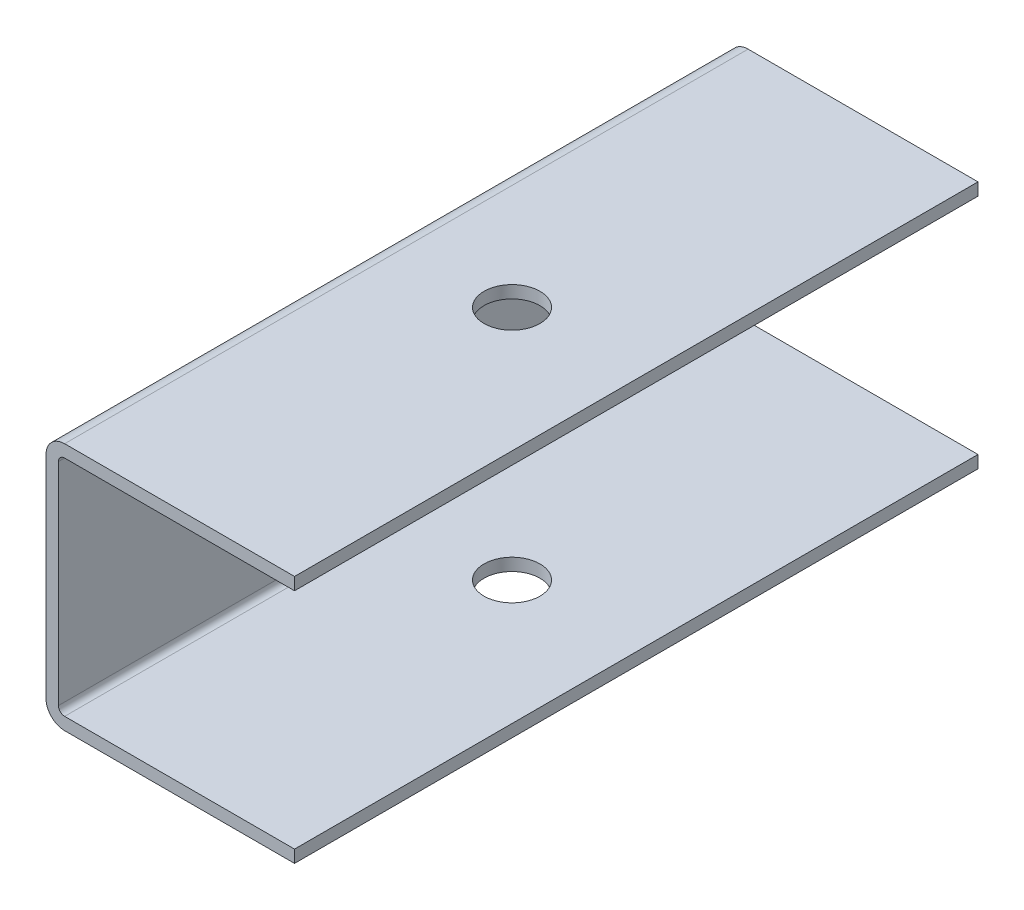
SolidWorks part; units mm, degrees
ref_plane "Face" through (0, 0, 0) normal (0, 0, 1) x (1, 0, 0)
ref_plane "Dessus" through (0, 0, 0) normal (0, 1, 0) x (1, 0, 0)
ref_plane "Droite" through (0, 0, 0) normal (1, 0, 0) x (0, 0, -1)
sketch "Esquisse1" plane through (0, 0, 0) normal (0, 0, 1) x (1, 0, 0)
  line L0 (2, -3) -> (2, -37)
  line L1 (3, 0) -> (40, 0)
  line L2 (0, -3) -> (0, -37)
  line L3 (3, -40) -> (40, -40)
  line L4 (40, 0) -> (40, -2)
  line L5 (3, -38) -> (40, -38)
  line L6 (40, -38) -> (40, -40)
  line L7 (3, -2) -> (40, -2)
  arc A0 (0, -3) -> (3, 0) centre (3, -3) cw
  arc A1 (3, -40) -> (0, -37) centre (3, -37) cw
  arc A2 (3, -38) -> (2, -37) centre (3, -37) cw
  arc A3 (2, -3) -> (3, -2) centre (3, -3) cw
  point P7 (0, 0)
  point P10 (0, -40)
  dimension "D3" = 3
  dimension "D1" = 40
  dimension "D2" = 40
  dimension "D4" = 2
extrude "Base-Extrusion" add sketch "Esquisse1" along normal blind 110
sketch "Esquisse2" plane through (0, 0, 0) normal (0, 1, 0) x (-1, 0, 0)
  line L0 (-40, 110) -> (-40, 0) construction
  line L1 (-40, 0) -> (-3, 0) construction
  circle A0 centre (-20, 55) radius 4.5
  dimension "D1" = 9
  dimension "D2" = 20
  dimension "D3" = 55
extrude "Enlèv. mat.-Extru.1" cut sketch "Esquisse2" against normal through all
